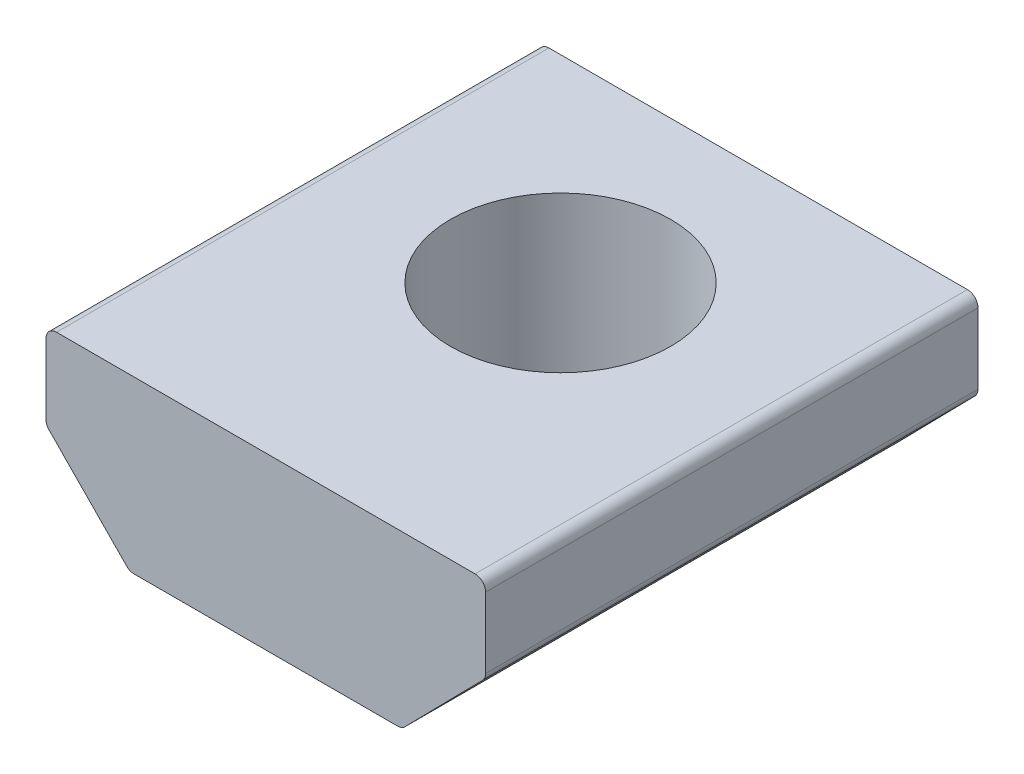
SolidWorks part; units mm, degrees
ref_plane "Front Plane" through (0, 0, 0) normal (0, 0, 1) x (1, 0, 0)
ref_plane "Top Plane" through (0, 0, 0) normal (0, 1, 0) x (1, 0, 0)
ref_plane "Right Plane" through (0, 0, 0) normal (1, 0, 0) x (0, 0, -1)
sketch "Sketch1" plane through (0, 0, 0) normal (0, 0, 1) x (1, 0, 0)
  line L0 (-7.5565, 0) -> (7.5565, 0)
  line L1 (7.9375, -0.381) -> (7.9375, -2.924)
  line L2 (-4.755, -6.1595) -> (4.755, -6.1595)
  line L3 (-7.9375, -0.381) -> (-7.9375, -2.924)
  line L4 (-7.8284, -3.1909) -> (-5.0269, -6.0454)
  line L5 (5.0269, -6.0454) -> (7.8284, -3.1909)
  arc A0 (-7.5565, 0) -> (-7.9375, -0.381) centre (-7.5565, -0.381) ccw
  arc A1 (-7.9375, -2.924) -> (-7.8284, -3.1909) centre (-7.5565, -2.924) ccw
  arc A2 (-5.0269, -6.0454) -> (-4.755, -6.1595) centre (-4.755, -5.7785) ccw
  arc A3 (4.755, -6.1595) -> (5.0269, -6.0454) centre (4.755, -5.7785) ccw
  arc A4 (7.8284, -3.1909) -> (7.9375, -2.924) centre (7.5565, -2.924) ccw
  arc A5 (7.9375, -0.381) -> (7.5565, 0) centre (7.5565, -0.381) ccw
  point P19 (0, 0)
extrude "Extrude1" add sketch "Sketch1" along normal blind 17.78
sketch "Sketch2" plane through (0, 0, 0) normal (0, 1, 0) x (-1, 0, 0)
  line L0 (-7.5565, 0) -> (7.5565, 0) construction
  line L1 (0, 0) -> (0, 17.78) construction
  line L2 (-7.5565, 17.78) -> (7.5565, 17.78) construction
  circle A0 centre (0, 7.1374) radius 3.9751
  dimension "D1" = 7.1374
  dimension "D2" = 7.9502
extrude "Cut-Extrude1" cut sketch "Sketch2" against normal through all
